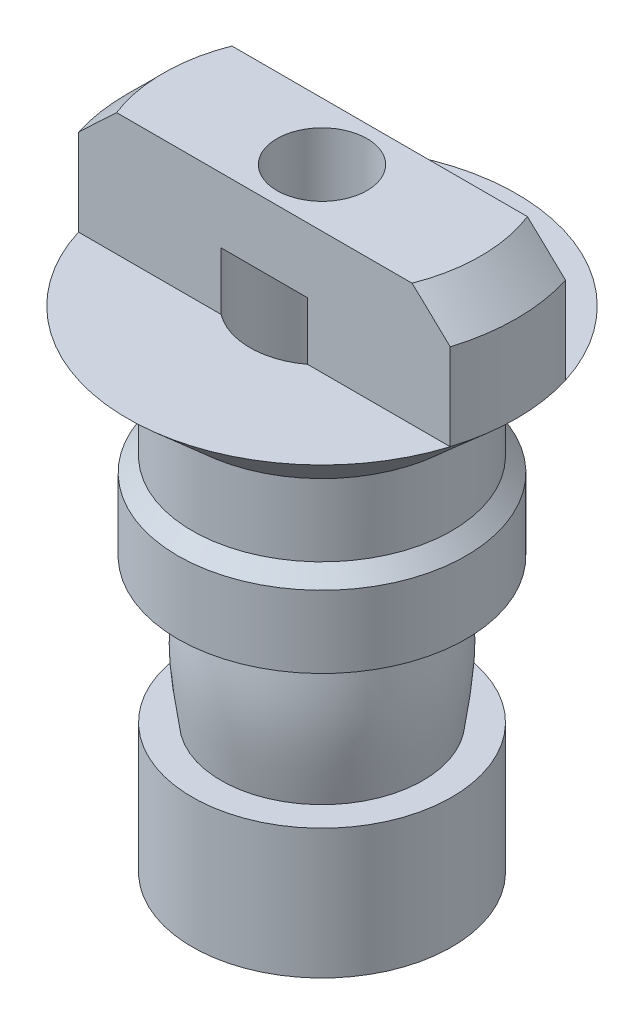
SolidWorks part; units mm, degrees
ref_plane "Face" through (0, 0, 0) normal (0, 0, 1) x (1, 0, 0)
ref_plane "Dessus" through (0, 0, 0) normal (0, 1, 0) x (1, 0, 0)
ref_plane "Droite" through (0, 0, 0) normal (1, 0, 0) x (0, 0, -1)
sketch "Esquisse1" plane through (0, 0, 0) normal (0, 0, 1) x (1, 0, 0)
  line L0 (0, 0) -> (0, 20.341) construction
  line L1 (0, 0) -> (22, 0)
  line L2 (22, 0) -> (27, -5)
  line L3 (27, -5) -> (27, -17)
  line L4 (27, -17) -> (18, -25)
  line L5 (18, -25) -> (18, -35)
  line L6 (14, -67) -> (18, -67)
  line L7 (20, -37) -> (20, -47)
  line L8 (20, -47) -> (14, -47)
  line L10 (0, -85) -> (18, -85)
  line L11 (0, -85) -> (0, 0)
  line L12 (18, -35) -> (20, -37)
  line L13 (18, -67) -> (18, -85)
  point P11 (15, -57.2254)
  dimension "D1" = 22
  dimension "D2" = 5
  dimension "D3" = 5
  dimension "D4" = 12
  dimension "D5" = 8
  dimension "D6" = 9
  dimension "D7" = 10
  dimension "D8" = 2
  dimension "D9" = 2
  dimension "D10" = 10
  dimension "D11" = 6
  dimension "D12" = 4
  dimension "D13" = 18
  dimension "D14" = 20
  dimension "D15" = 15
  dimension "D16" = 18
revolve "Révolution1" add sketch "Esquisse1" angle 360 about L0
sketch "Esquisse2" plane through (0, 0, 0) normal (1, 0, 0) x (0, 0, -1)
  line L2 (27, -17) -> (-27, -17) construction
  line L3 (-8, -17) -> (-48.2726, -17)
  line L4 (-8, -17) -> (-8, 21.35)
  line L5 (-8, 21.35) -> (-48.2726, 21.35)
  line L6 (0, 0) -> (0, 10.3945) construction
  line L7 (-48.2726, -17) -> (-48.2726, 21.35)
  line L9 (8, -17) -> (39.3713, -17)
  line L10 (8, -17) -> (8, 21.35)
  line L12 (8, 21.35) -> (39.3713, 21.35)
  line L13 (39.3713, -17) -> (39.3713, 21.35)
  dimension "D1" = 16
extrude "Enlèv. mat.-Extru.1" cut sketch "Esquisse2" against normal mid plane 80
sketch "Esquisse3" plane through (0, 0, 0) normal (0, 1, 0) x (-1, 0, 0)
  circle A0 centre (0, 0) radius 6.25
  dimension "D1" = 12.5
extrude "Enlèv. mat.-Extru.2" cut sketch "Esquisse3" against normal through all
sketch "Esquisse4" plane through (0, -85, 0) normal (0, -1, 0) x (1, 0, 0)
  circle A0 centre (0, 0) radius 10
  dimension "D1" = 20
extrude "Enlèv. mat.-Extru.3" cut sketch "Esquisse4" against normal blind 76
chamfer "Chanfrein1" distance 3 distance2 4
